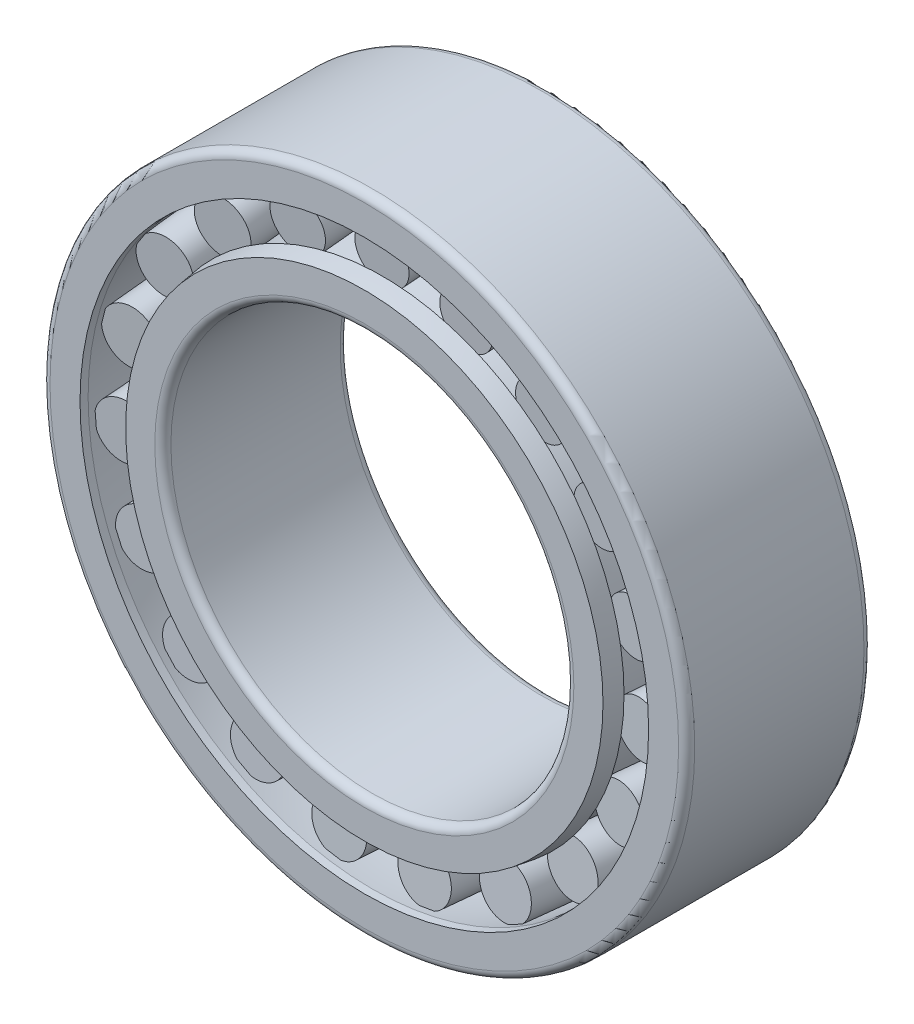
SolidWorks part; units mm, degrees
ref_plane "Front Plane" through (0, 0, 0) normal (0, 0, 1) x (1, 0, 0)
ref_plane "Top Plane" through (0, 0, 0) normal (0, 1, 0) x (1, 0, 0)
ref_plane "Right Plane" through (0, 0, 0) normal (1, 0, 0) x (0, 0, -1)
sketch "BaseSke" plane through (0, 0, 0) normal (1, 0, 0) x (0, 0, -1)
  line L0 (-47.2296, 0) -> (69.4868, 0) construction
  line L2 (0, 129.5214) -> (0, 36.0472) construction
  line L3 (-11.5, 25) -> (-11.5, 29.6154) construction
  line L4 (-11.5, 40) -> (11.5, 40) construction
  line L5 (-11.5, 25) -> (11.5, 25) construction
  line L7 (11.5, 25) -> (11.5, 29.6154) construction
  line L8 (11.5, 35.1538) -> (11.5, 40) construction
  line L9 (-11.5, 35.1538) -> (-11.5, 40) construction
  line L11 (0, 33.3138) -> (-11.5, 32.3846) construction
  line L12 (0, 33.3138) -> (11.5, 32.3846) construction
  line L13 (-11.5, 35.1538) -> (-11.5, 29.6154) construction
  line L14 (0, 30.5805) -> (0, -86.3012) construction
  line L15 (0, 36.0472) -> (0, 30.5805) construction
  line L16 (-9.3136, 32.1767) -> (-9.0438, 28.8379) construction
  line L17 (-9.5833, 35.5155) -> (-1.9416, 36.133)
  line L18 (-9.5833, 35.5155) -> (-9.3136, 32.1767)
  line L19 (-9.0438, 28.8379) -> (-1.402, 29.4553) construction
  line L20 (-1.9416, 36.133) -> (-1.6718, 32.7942)
  line L21 (-1.402, 29.4553) -> (-1.6718, 32.7942) construction
  line L22 (-9.3136, 32.1767) -> (-1.6718, 32.7942)
  line L23 (-11.5, 32) -> (0, 32.9292) construction
  arc A1 (-11.5, 35.1538) -> (11.5, 35.1538) centre (0, -38.4195) cw construction
  arc A2 (11.5, 29.6154) -> (-11.5, 29.6154) centre (0, -38.4195) ccw construction
  dimension "D2" = 4.6154
  dimension "D1" = 69
  dimension "Bearing_Thickness" = 23
  dimension "Bearing_Outside_Diameter" = 80
  dimension "Bearing_Inside_Diameter" = 50
  dimension "D3" = 4.8462
  dimension "D4" = 7.6667
  dimension "D5" = 1.9167
  dimension "D6" = 0.3833
revolve "Roller" add sketch "BaseSke" angle 360 about L23
sketch "OuterRaceSke" plane through (0, 0, 0) normal (1, 0, 0) x (0, 0, -1)
  line L0 (0, 0) -> (0, 94.5438) construction
  line L1 (-11.5, 40) -> (11.5, 40)
  line L2 (-11.5, 40) -> (-11.5, 35.1103)
  line L3 (11.5, 40) -> (11.5, 35.1103)
  line L5 (-50.3916, 0) -> (55.2197, 0) construction
  arc A0 (-11.5, 35.1103) -> (11.5, 35.1103) centre (0, -38.4195) cw
  arc A2 (11.5, 35.1538) -> (-11.5, 35.1538) centre (0, -38.4195) ccw construction
  dimension "D1" = 0.043
revolve "OuterRace" add sketch "OuterRaceSke" angle 360 about L5
sketch "InnerRaceSke" plane through (0, 0, 0) normal (1, 0, 0) x (0, 0, -1)
  line L0 (-70.8626, 0) -> (113.5527, 0) construction
  line L1 (0, 90.393) -> (0, -90.393) construction
  line L2 (-11.5, 25) -> (11.5, 25)
  line L3 (-11.5, 25) -> (-11.5, 29.6154)
  line L4 (-9.2347, 29.9597) -> (-9.1469, 28.8727)
  line L5 (-9.1469, 28.8727) -> (-1.3058, 29.5062)
  line L7 (-1.3058, 29.5062) -> (-1.3915, 30.5664)
  line L8 (-9.3136, 32.1767) -> (-9.0438, 28.8379) construction
  line L9 (1.3058, 29.5062) -> (1.3915, 30.5664)
  line L10 (-1.402, 29.4553) -> (-1.6718, 32.7942) construction
  line L11 (-9.0438, 28.8379) -> (-1.402, 29.4553) construction
  line L14 (9.1469, 28.8727) -> (1.3058, 29.5062)
  line L15 (9.2347, 29.9597) -> (9.1469, 28.8727)
  line L16 (11.5, 25) -> (11.5, 29.6154)
  arc A0 (-11.5, 29.6154) -> (-9.2347, 29.9597) centre (0, -38.4195) cw
  arc A1 (11.5, 29.6154) -> (-11.5, 29.6154) centre (0, -38.4195) ccw construction
  arc A2 (-1.3915, 30.5664) -> (1.3915, 30.5664) centre (0, -38.4195) cw
  arc A3 (11.5, 29.6154) -> (9.2347, 29.9597) centre (0, -38.4195) ccw
  point P38 (0, 25)
  dimension "D2" = 0.1
  dimension "D1" = 0.043
  dimension "D3" = 0.1
revolve "InnerRace" add sketch "InnerRaceSke" angle 360 about L0
mirror "MirrorRoller" about plane through (0, 0, 0) normal (0, 0, 1) of "Roller"
fillet "Fillet1" radius 1 4 edges at (25, 0, 11.5) (40, 0, 11.5) (25, 0, -11.5) (40, 0, -11.5)
pattern_circular "CirPatternBall" count 19 over 360 about axis through (0, 0, 0) along (0, 0, 1) of "Roller", "MirrorRoller"
sketch "SimplifiedSke" plane through (0, 0, 0) normal (1, 0, 0) x (0, 0, -1)
  line L0 (37.5911, 0) -> (-37.5911, 0) construction
  line L1 (0, 0) -> (0, 96.8272) construction
  line L2 (-9.0438, 28.8379) -> (-1.402, 29.4553)
  line L3 (-9.0438, 28.8379) -> (-9.5833, 35.5155)
  line L4 (-9.5833, 35.5155) -> (-1.9416, 36.133)
  line L5 (-1.402, 29.4553) -> (-1.9416, 36.133)
  line L7 (1.402, 29.4553) -> (1.9416, 36.133)
  line L8 (9.0438, 28.8379) -> (1.402, 29.4553)
  line L9 (9.0438, 28.8379) -> (9.5833, 35.5155)
  line L10 (9.5833, 35.5155) -> (1.9416, 36.133)
revolve "Simplified" [suppressed] add sketch "SimplifiedSke" angle 360 about L0
chamfer "Chamfer" distance 0.9583 angle 10 2 edges at (35.1103, 0, -11.5) (35.1103, 0, 11.5)
equation "\"D1@BaseSke\" = \"Bearing_Thickness@BaseSke\"*3"
equation "\"D2@BaseSke\" =  ( \"Bearing_Outside_Diameter@BaseSke\" - \"Bearing_Inside_Diameter@BaseSke\" ) /6.5"
equation "\"D3@BaseSke\" = \"D2@BaseSke\"*1.05"
equation "\"D4@BaseSke\" = \"Bearing_Thickness@BaseSke\"/3"
equation "\"D5@BaseSke\" = \"Bearing_Thickness@BaseSke\"/12"
equation "\"D6@BaseSke\" = \"Bearing_Thickness@BaseSke\"/60"
equation "\"D1@OuterRaceSke\" = 0.02+\"Bearing_Thickness@BaseSke\" * 0.001"
equation "\"D1@InnerRaceSke\" = \"D1@OuterRaceSke\""
equation "\"D1@CirPatternBall\" =  int(  ( \"Bearing_Outside_Diameter@BaseSke\" + \"Bearing_Inside_Diameter@BaseSke\" )  / 2 *  pi  /  ( \"Bearing_Outside_Diameter@BaseSke\" - \"Bearing_Inside_Diameter@BaseSke\" ) * 2.8 "
equation "\"D1@Chamfer\" = \"Bearing_Thickness@BaseSke\"/24"
